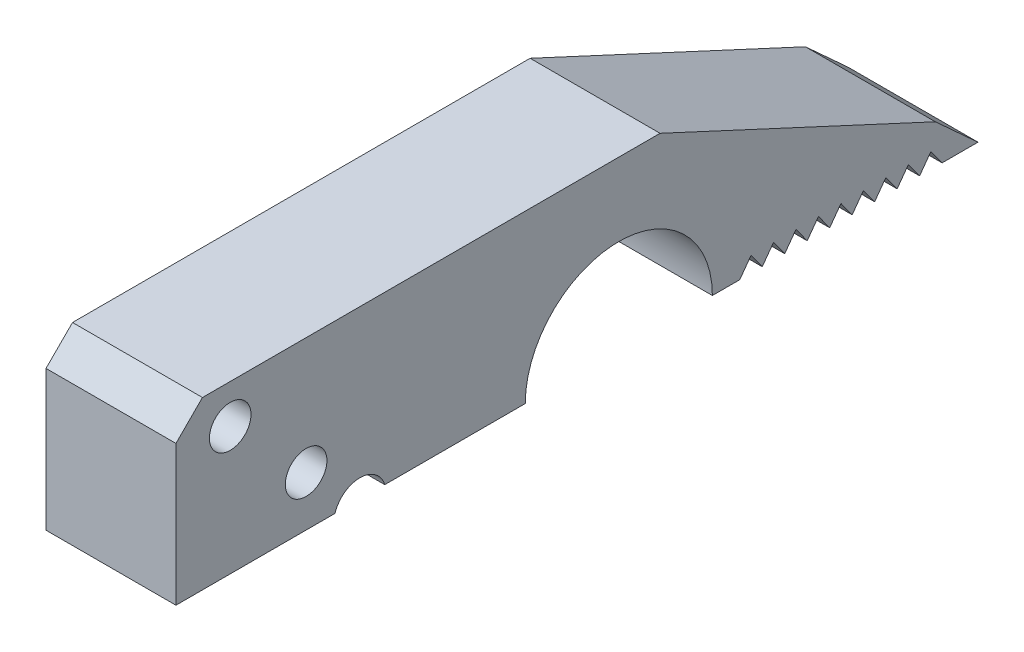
SolidWorks part; units mm, degrees
ref_plane "Front Plane" through (0, 0, 0) normal (0, 0, 1) x (1, 0, 0)
ref_plane "Top Plane" through (0, 0, 0) normal (0, 1, 0) x (1, 0, 0)
ref_plane "Right Plane" through (0, 0, 0) normal (1, 0, 0) x (0, 0, -1)
sketch "Sketch3" plane through (0, 0, 0) normal (1, 0, 0) x (0, 0, -1)
  line L4 (-10.7902, 1.4187) -> (-10.7902, 11.4187)
  line L10 (11.0435, 0) -> (11.0435, 15.403) construction
  line L11 (-10.7902, 11.4187) -> (26.4654, 11.4187)
  line L15 (47.6516, 1.5935) -> (26.4654, 11.4187)
  line L22 (-10.7902, -1.4067) -> (-10.7902, 1.4187)
  line L23 (47.6516, 1.5935) -> (50.9317, -0.9746)
  line L25 (30.4703, -1.2146) -> (30.4703, 0.0004)
  line L26 (30.4703, -1.2146) -> (32.6009, -1.1861) construction
  line L27 (30.4703, -1.2146) -> (32.6009, -1.1861)
  line L28 (32.6009, -1.1861) -> (33.403, 0.0029)
  line L29 (33.403, 0.0029) -> (34.3309, -1.163)
  line L30 (34.3309, -1.163) -> (35.133, 0.026)
  line L31 (35.133, 0.026) -> (36.0609, -1.1399)
  line L32 (36.0609, -1.1399) -> (36.863, 0.0491)
  line L33 (36.863, 0.0491) -> (37.7909, -1.1168)
  line L34 (37.7909, -1.1168) -> (38.593, 0.0722)
  line L35 (38.593, 0.0722) -> (39.5208, -1.0936)
  line L36 (39.5208, -1.0936) -> (40.3228, 0.0953)
  line L37 (40.3228, 0.0953) -> (41.2506, -1.0705)
  line L38 (41.2506, -1.0705) -> (42.0527, 0.1184)
  line L39 (42.0527, 0.1184) -> (42.9804, -1.0474)
  line L40 (42.9804, -1.0474) -> (43.7825, 0.1415)
  line L41 (43.7825, 0.1415) -> (44.7103, -1.0243)
  line L42 (44.7103, -1.0243) -> (45.5123, 0.1646)
  line L43 (45.5123, 0.1646) -> (46.4401, -1.0012)
  line L48 (47.6516, 0) -> (49.6869, 0) construction
  line L50 (48.4273, -0.9746) -> (50.9317, -0.9746)
  line L51 (48.17, -0.9781) -> (48.4273, -0.9746)
  line L52 (46.4401, -1.0012) -> (47.2422, 0.1877)
  line L53 (47.2422, 0.1877) -> (48.17, -0.9781)
  line L54 (-0.7725, 10) -> (-0.7725, -1.3601) construction
  line L55 (-10.7902, -1.4067) -> (-0.7725, -1.3558) construction
  line L56 (-10.7902, -1.4067) -> (1.5022, -1.3495)
  line L57 (30.4703, -1.1969) -> (32.6009, -1.1861) construction
  line L59 (5.2788, -1.3319) -> (16.0921, -1.2815)
  arc A3 (3.3936, 0.0005) -> (5.2788, -1.3319) centre (3.3936, -1.9995) cw
  arc A5 (16.0921, -1.2815) -> (30.4703, 0.0004) centre (23.3495, -1.4067) cw
  arc A6 (3.3936, 0.0005) -> (1.5022, -1.3495) centre (3.3936, -1.9995) ccw
  circle A7 centre (-6.6137, 8.4298) radius 1.5
  circle A8 centre (-0.7725, 2.4337) radius 1.5
  dimension "D2" = 2
  dimension "D3" = 2
  dimension "D4" = 10.0177
  dimension "D5" = 1.73
  dimension "D14" = 3
  dimension "D15" = 3
  dimension "D1" = 10
  dimension "D6" = 1.73
  dimension "D7" = 1.73
  dimension "D8" = 1.73
  dimension "D9" = 1.73
  dimension "D10" = 1.73
  dimension "D11" = 1.73
  dimension "D12" = 1.73
  dimension "D13" = 1.73
ref_plane "Plane1" through (0, -1.637, 0) normal (0, 1, 0) x (1, 0, 0)
sketch "Sketch7" plane through (0, 0, 0) normal (1, 0, 0) x (0, 0, -1)
  line L0 (-10.7902, -1.4067) -> (50.9332, -1.4067) construction
  line L1 (-10.7902, -1.4067) -> (-10.7902, 9.3787)
  line L2 (-8.7503, 11.4187) -> (26.4654, 11.4187)
  line L3 (-10.7902, -1.4067) -> (1.4524, -1.4067)
  line L4 (5.2788, -1.4067) -> (16.0923, -1.4067)
  line L5 (30.4923, -1.4067) -> (32.6011, -1.4067)
  line L6 (32.6011, -1.4067) -> (33.4661, -0.2162)
  line L7 (33.4661, -0.2162) -> (34.3311, -1.4067)
  line L8 (33.4661, -0.2162) -> (33.4661, -1.4067) construction
  line L9 (34.3311, -1.4067) -> (35.1961, -0.2162)
  line L10 (35.1961, -0.2162) -> (36.0611, -1.4067)
  line L11 (36.0611, -1.4067) -> (36.9261, -0.2162)
  line L12 (36.9261, -0.2162) -> (37.7911, -1.4067)
  line L13 (37.7911, -1.4067) -> (38.6561, -0.2162)
  line L14 (38.6561, -0.2162) -> (39.5211, -1.4067)
  line L15 (39.5211, -1.4067) -> (40.3861, -0.2162)
  line L16 (40.3861, -0.2162) -> (41.2511, -1.4067)
  line L17 (41.2511, -1.4067) -> (42.1161, -0.2162)
  line L18 (42.1161, -0.2162) -> (42.9811, -1.4067)
  line L19 (42.9811, -1.4067) -> (43.8461, -0.2162)
  line L20 (43.8461, -0.2162) -> (44.7111, -1.4067)
  line L21 (44.7111, -1.4067) -> (45.5761, -0.2162)
  line L22 (45.5761, -0.2162) -> (46.4411, -1.4067)
  line L23 (46.4411, -1.4067) -> (47.3061, -0.2162)
  line L24 (47.3061, -0.2162) -> (48.1711, -1.4067)
  line L25 (48.1711, -1.4067) -> (50.9332, -1.4067)
  line L26 (50.9332, -1.4067) -> (47.6516, 1.5935)
  line L27 (26.4654, 11.4187) -> (47.6516, 1.5935)
  line L28 (-8.7503, 11.4187) -> (-8.7503, 9.3787) construction
  line L29 (-8.7503, 9.3787) -> (-10.7902, 9.3787) construction
  line L30 (-8.7503, 11.4187) -> (-10.7902, 9.3787)
  line L31 (-10.7902, 9.3787) -> (-10.7902, 11.4187) construction
  line L32 (-10.7902, 11.4187) -> (-8.7503, 11.4187) construction
  line L33 (-6.6137, 8.4298) -> (-6.6137, 11.4187) construction
  line L34 (-0.7725, 2.4337) -> (-0.7725, -1.3558) construction
  arc A0 (1.4524, -1.4067) -> (5.2788, -1.4067) centre (3.3656, -1.9894) cw
  arc A1 (16.0923, -1.4067) -> (30.4923, -1.4067) centre (23.2923, -1.4067) cw
  circle A2 centre (-6.6137, 8.4298) radius 1.6
  circle A3 centre (-0.7725, 2.4337) radius 1.6
  dimension "D9" = 2
  dimension "D11" = 7.2
  dimension "D21" = 3.2
  dimension "D23" = 3.2
  dimension "D1" = 10.7902
  dimension "D2" = 1.4067
  dimension "D3" = 12.8254
  dimension "D4" = 37.2557
  dimension "D5" = 36
  dimension "D6" = 36
  dimension "D7" = 1.1906
  dimension "D8" = 61.7234
  dimension "D10" = 3.8265
  dimension "D12" = 14.4
  dimension "D13" = 12.2426
  dimension "D14" = 10.8134
  dimension "D15" = 2.1088
  dimension "D17" = 2.04
  dimension "D18" = 4.4464
  dimension "D19" = 3.0003
  dimension "D20" = 2.9889
  dimension "D22" = 3.7895
  dimension "D24" = 4.1765
  dimension "D16" = 9
extrude "Boss-Extrude2" add sketch "Sketch7" along normal blind 10
